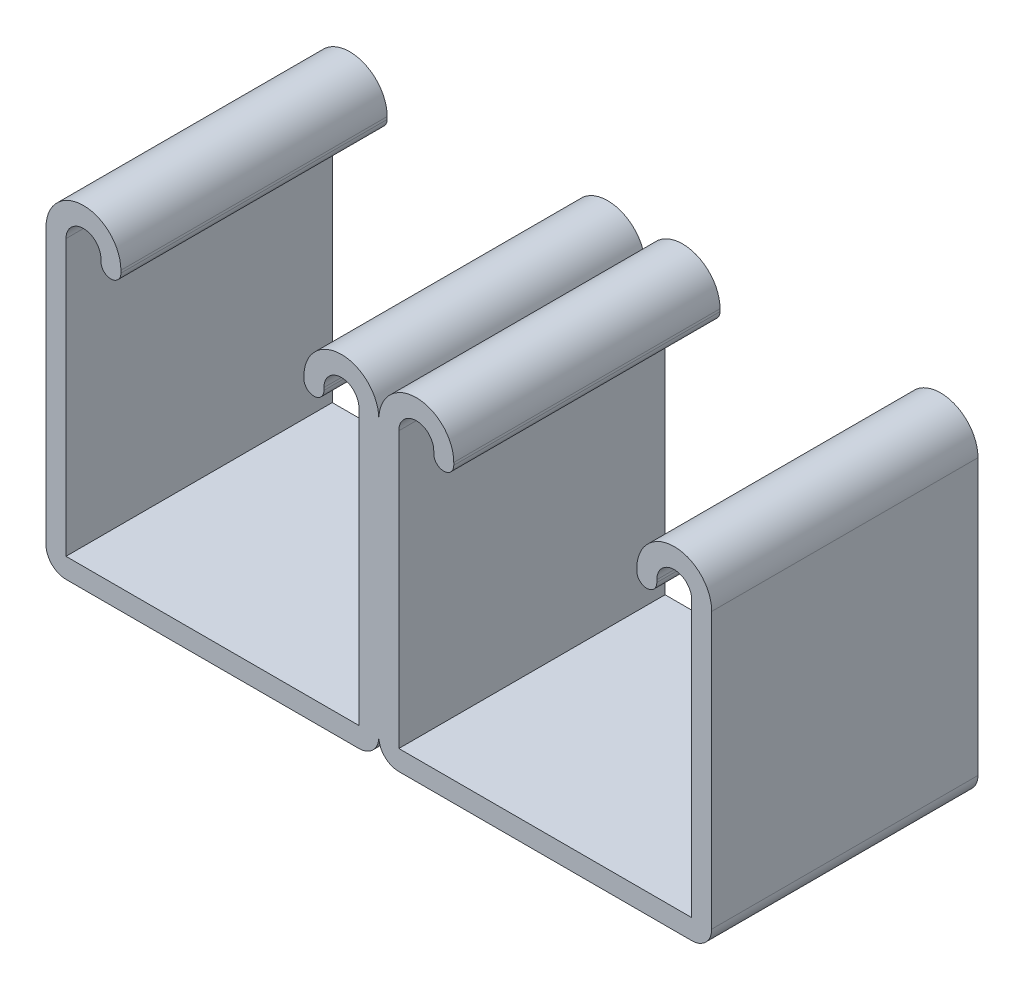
SolidWorks part; units mm, degrees
ref_plane "Plane1" through (0, 0, 0) normal (0, 0, 1) x (1, 0, 0)
ref_plane "Plane2" through (0, 0, 0) normal (0, 1, 0) x (1, 0, 0)
ref_plane "Plane3" through (0, 0, 0) normal (1, 0, 0) x (0, 0, -1)
sketch "Sketch1" plane through (0, 0, 0) normal (0, 0, 1) x (1, 0, 0)
  line L0 (-31.75, 14.3351) -> (-31.75, -11.9126)
  line L1 (-29.845, -13.8176) -> (-1.905, -13.8176)
  line L2 (0, -11.9126) -> (0, 14.3351)
  line L3 (-7.1437, 14.3351) -> (-7.1438, 14.097)
  line L4 (-24.6062, 14.3351) -> (-24.6062, 14.097)
  line L5 (-26.5112, 14.3351) -> (-26.5113, 14.097)
  line L6 (-29.845, 14.3351) -> (-29.845, -11.9126)
  line L7 (-29.845, -11.9126) -> (-1.905, -11.9126)
  line L8 (-1.905, -11.9126) -> (-1.905, 14.3351)
  line L9 (-5.2387, 14.3351) -> (-5.2388, 14.097)
  line L10 (-44.483, 17.907) -> (25.4, 17.907) construction
  line L11 (-36.5125, 13.1445) -> (12.8524, 13.1445) construction
  arc A0 (0, 14.3351) -> (-7.1437, 14.3351) centre (-3.5719, 14.3351) ccw
  arc A1 (-31.75, 14.3351) -> (-24.6062, 14.3351) centre (-28.1781, 14.3351) cw
  arc A2 (-29.845, -13.8176) -> (-31.75, -11.9126) centre (-29.845, -11.9126) cw
  arc A3 (-1.905, -13.8176) -> (0, -11.9126) centre (-1.905, -11.9126) ccw
  arc A4 (-29.845, 14.3351) -> (-26.5112, 14.3351) centre (-28.1781, 14.3351) cw
  arc A5 (-1.905, 14.3351) -> (-5.2387, 14.3351) centre (-3.5719, 14.3351) ccw
  arc A6 (-7.1438, 14.097) -> (-5.2388, 14.097) centre (-6.1913, 14.097) ccw
  arc A7 (-24.6062, 14.097) -> (-26.5113, 14.097) centre (-25.5587, 14.097) cw
  dimension "D1" = 1.905
  dimension "Width" = 31.75
  dimension "D5" = 13.8176
  dimension "D6" = 7.1437
  dimension "D7" = 17.4625
  dimension "D8" = 17.907
  dimension "D9" = 4.7625
  dimension "gauge" = 1.905
extrude "Base-Extrude" add sketch "Sketch1" along normal mid plane 25.4
pattern_linear "LPattern1" count 2 spacing 31.75 along (1, 0, 0) of "Base-Extrude"
equation "\"D7@Sketch1\" = \"Width@Sketch1\" - 2 * \"D6@Sketch1\""
equation "\"D1@Sketch1\" = \"gauge@Sketch1\""
